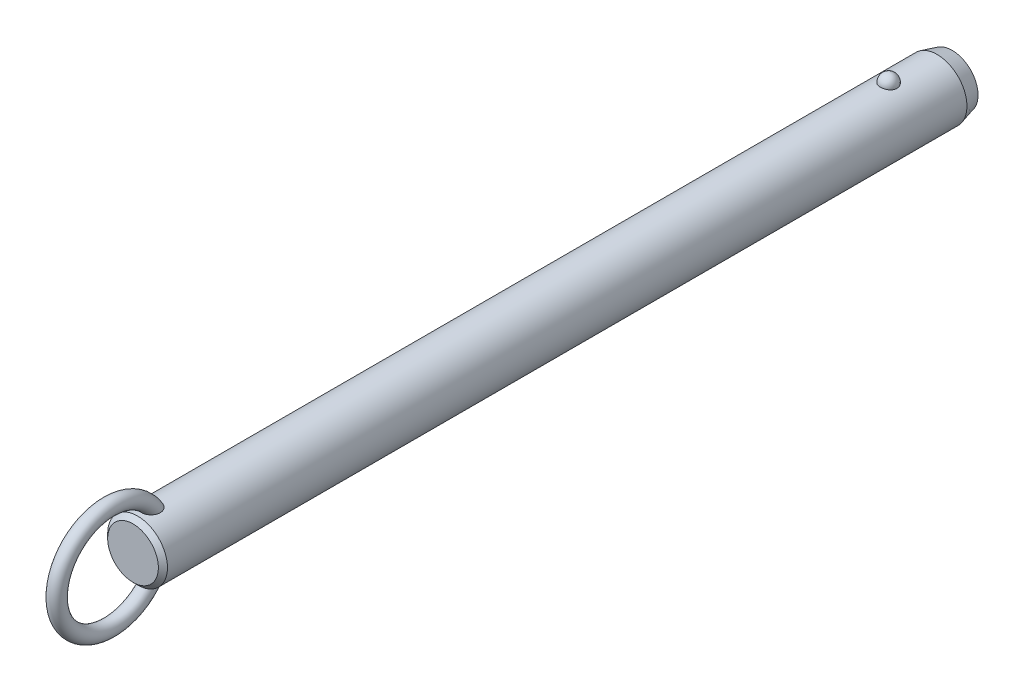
SolidWorks part; units mm, degrees
ref_plane "Front Plane" through (0, 0, 0) normal (0, 0, 1) x (1, 0, 0)
ref_plane "Top Plane" through (0, 0, 0) normal (0, 1, 0) x (1, 0, 0)
ref_plane "Right Plane" through (0, 0, 0) normal (1, 0, 0) x (0, 0, -1)
sketch "Sketch2" plane through (0, 0, 0) normal (0, 0, 1) x (1, 0, 0)
  circle A0 centre (0, 0) radius 7.9
  point P3 (0, 7.9)
  dimension "D1" = 15.8
extrude "Boss-Extrude1" add sketch "Sketch2" along normal blind 188
sketch "Sketch3" plane through (0, 0, 0) normal (0, 0, -1) x (-1, 0, 0)
  circle A0 centre (0, 0) radius 7.9
  dimension "D1" = 15.8
extrude "Boss-Extrude2" add sketch "Sketch3" along normal blind 19
chamfer "Chamfer1" distance 4 angle 15 1 edges at (-7.9, 0, -19)
sketch "Sketch12" plane through (0, 0, 0) normal (1, 0, 0) x (0, 0, -1)
  line L0 (-188, 7.9) -> (-188, -7.9) construction
  point P0 (-188, 0)
sketch "Sketch13" plane through (0, 0, 0) normal (1, 0, 0) x (0, 0, -1)
  circle A0 centre (-203.85, 0) radius 15.85
  point P2 (-188, 0)
  dimension "D1" = 31.7
sketch "Sketch14" plane through (0, 0, 0) normal (0, 1, 0) x (1, 0, 0)
  circle A0 centre (0, -190) radius 2
  point P2 (0, -188)
  dimension "D1" = 4
sweep "Sweep1" add profiles "Sketch14" path "Sketch13"
sketch "Sketch15" plane through (0, 0, 188) normal (0, 0, 1) x (1, 0, 0)
  circle A0 centre (0, 0) radius 7.9
  dimension "D1" = 15.8
extrude "Boss-Extrude3" add sketch "Sketch15" along normal blind 9.52
chamfer "Chamfer2" distance 1.2 angle 45 1 edges at (7.9, 0, 197.52)
sketch "Sketch18" plane through (0, 0, 0) normal (1, 0, 0) x (0, 0, -1)
  line L0 (15, 7.9) -> (-190.1091, 7.9) construction
  line L1 (2.2, 10.1) -> (2.2, 5.7)
  line L2 (-190.1091, -7.9) -> (15, -7.9) construction
  arc A0 (2.2, 10.1) -> (2.2, 5.7) centre (2.2, 7.9) ccw
  point P4 (0, 7.9)
  dimension "D1" = 18
revolve "Revolve1" add sketch "Sketch18" angle 360 about L1
